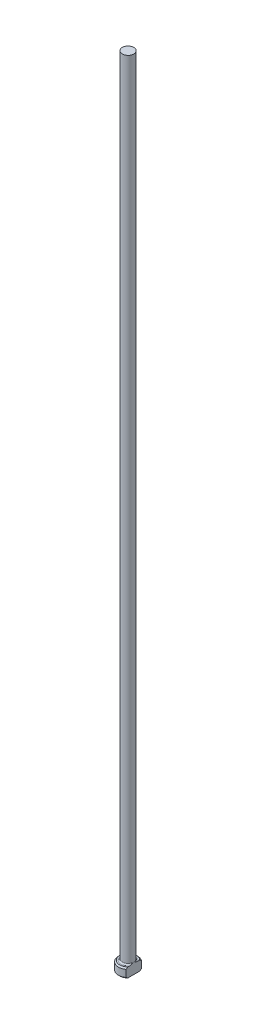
SolidWorks part; units mm, degrees
ref_plane "Front Plane" through (0, 0, 0) normal (0, 0, 1) x (1, 0, 0)
ref_plane "Top Plane" through (0, 0, 0) normal (0, 1, 0) x (1, 0, 0)
ref_plane "Right Plane" through (0, 0, 0) normal (1, 0, 0) x (0, 0, -1)
sketch "Sketch1" plane through (0, 0, 0) normal (0, 0, 1) x (1, 0, 0)
  line L0 (0, 259.9588) -> (0, -15.1925) construction
  line L1 (0, 0) -> (-1.5, 0)
  line L2 (-1.5, 0) -> (-1.5, 1.5)
  line L3 (-1.5, 1.5) -> (-0.9, 1.5)
  line L4 (-0.9, 1.5) -> (-0.9, 125)
  line L5 (-0.9, 125) -> (0, 125)
  line L6 (0, 125) -> (0, 0)
  dimension "L" = 125
  dimension "H" = 3
  dimension "T" = 1.5
  dimension "D" = 1.8
revolve "Revolve1" add sketch "Sketch1" angle 360 about L0
chamfer "Chamfer1" distance 0.2 angle 45 2 edges at (0, 1.5, 1.5) (0, 0, 1.5)
fillet "Fillet1" radius 0.2 1 edges at (0, 1.5, 0.9)
sketch "Sketch2" plane through (0, 0, 0) normal (0, 1, 0) x (1, 0, 0)
  line L0 (0.9, 1.2) -> (0.9, -1.2)
  circle A0 centre (0, 0) radius 1.5 construction
  arc A1 (0.9, -1.2) -> (0.9, 1.2) centre (0, 0) ccw
  circle A2 centre (0, 0) radius 0.9 construction
extrude "KEY" cut sketch "Sketch2" along normal through all
